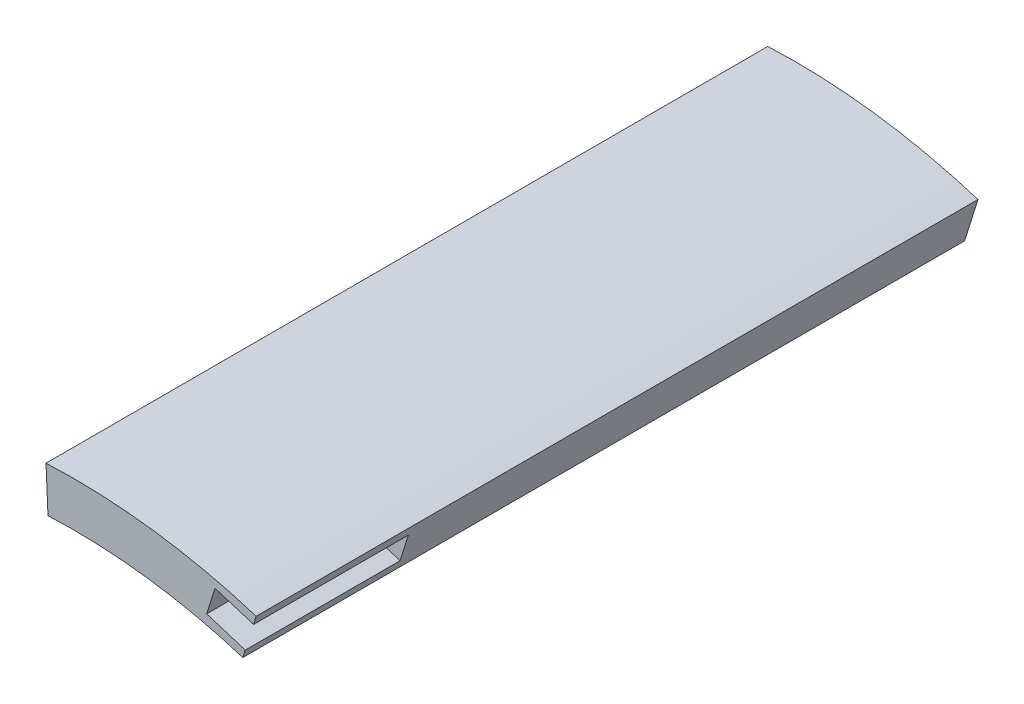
SolidWorks part; units mm, degrees
ref_plane "Přední rovina" through (0, 0, 0) normal (0, 0, 1) x (1, 0, 0)
ref_plane "Horní rovina" through (0, 0, 0) normal (0, 1, 0) x (1, 0, 0)
ref_plane "Pravá rovina" through (0, 0, 0) normal (1, 0, 0) x (0, 0, -1)
sketch "Skica1" plane through (0, 0, 0) normal (0, 0, 1) x (1, 0, 0)
  line L1 (140, -140) -> (-140, -140)
  line L2 (140, -140) -> (140, 140)
  line L3 (140, 140) -> (-140, 140)
  line L4 (-140, -140) -> (-140, 140)
  line L5 (140, -140) -> (-140, 140) construction
  line L6 (140, 140) -> (-140, -140) construction
  point P0 (0, 0)
  dimension "D1" = 280
  dimension "D2" = 280
extrude "Přidat vysunutím1" add sketch "Skica1" along normal blind 162
sketch "Skica2" plane through (0, 140, 0) normal (0, 1, 0) x (1, 0, 0)
  line L0 (-140, 0) -> (-140, -7.25)
  line L1 (-140, -162) -> (-140, 0) construction
  line L2 (-140, -7.25) -> (-140, -14.75)
  line L3 (-140, -14.75) -> (-140, -17.25)
  line L4 (-140, -17.25) -> (-140, -24.75)
  line L5 (-140, -24.75) -> (0, -24.75)
  line L6 (-140, -24.75) -> (-140, -27.25)
  line L7 (-140, -27.25) -> (0, -27.25)
  line L8 (-140, -27.25) -> (-140, -34.75)
  line L9 (-140, -34.75) -> (0, -34.75)
  line L10 (-140, -14.75) -> (0, -14.75)
  line L11 (-140, -37.25) -> (0, -37.25)
  line L12 (-140, -7.25) -> (0, -7.25)
  line L13 (-140, -17.25) -> (0, -17.25)
  line L14 (-140, -34.75) -> (-140, -36)
  line L15 (-140, -36) -> (140, -36) construction
  line L16 (140, -162) -> (140, 0) construction
  line L17 (0, 0) -> (0, -36) construction
  line L18 (-140, -44.75) -> (0, -44.75)
  line L19 (-140, -47.25) -> (0, -47.25)
  line L20 (-140, -54.75) -> (0, -54.75)
  line L21 (-140, -64.75) -> (0, -64.75)
  line L22 (-140, -57.25) -> (0, -57.25)
  line L23 (-140, -64.75) -> (-140, -67.25)
  line L24 (-140, -67.25) -> (-140, -74.75)
  line L25 (-140, -74.75) -> (-140, -77.25)
  line L26 (-140, -77.25) -> (-140, -84.75)
  line L27 (-140, -84.75) -> (0, -84.75)
  line L28 (-140, -84.75) -> (-140, -87.25)
  line L29 (-140, -87.25) -> (0, -87.25)
  line L30 (-140, -87.25) -> (-140, -94.75)
  line L31 (-140, -94.75) -> (0, -94.75)
  line L32 (-140, -74.75) -> (0, -74.75)
  line L33 (-140, -97.25) -> (0, -97.25)
  line L34 (-140, -67.25) -> (0, -67.25)
  line L35 (-140, -77.25) -> (0, -77.25)
  line L36 (-140, -94.75) -> (-140, -96)
  line L37 (0, -59.75) -> (0, -96) construction
  line L38 (-140, -104.75) -> (0, -104.75)
  line L39 (-140, -107.25) -> (0, -107.25)
  line L40 (-140, -114.75) -> (0, -114.75)
  line L41 (-140, -124.75) -> (0, -124.75)
  line L42 (-140, -117.25) -> (0, -117.25)
  line L43 (0, 0) -> (40, 0) construction
  line L44 (140, 0) -> (-140, 0) construction
  line L45 (40, 0) -> (40, -154.75) construction
  line L46 (140, -162) -> (-140, -162) construction
  line L47 (-140, -124.75) -> (-140, -127.25)
  line L48 (-140, -127.25) -> (32.8902, -127.25)
  line L49 (-140, -127.25) -> (-140, -134.75)
  line L50 (-140, -134.75) -> (24.5559, -134.75)
  line L51 (-140, -134.75) -> (-140, -137.25)
  line L52 (-140, -137.25) -> (-140, -144.75)
  line L53 (-140, -137.25) -> (27.0559, -137.25)
  line L54 (-140, -144.75) -> (24.5559, -144.75)
  line L55 (-140, -144.75) -> (-140, -147.25)
  line L56 (-140, -147.25) -> (27.0559, -147.25)
  line L57 (-140, -147.25) -> (-140, -154.75)
  line L58 (-140, -154.75) -> (30.93, -154.75)
  line L59 (30.93, -154.75) -> (40, -154.75)
  line L60 (40, -154.75) -> (40, -127.25)
  arc A0 (0, -27.25) -> (0, -44.75) centre (0, -36) cw
  arc A1 (0, -24.75) -> (0, -47.25) centre (0, -36) cw
  arc A2 (0, -17.25) -> (0, -54.75) centre (0, -36) cw
  arc A3 (0, -14.75) -> (0, -57.25) centre (0, -36) cw
  arc A4 (0, -7.25) -> (0, -64.75) centre (0, -36) cw
  arc A5 (1.25, -36) -> (0, -34.75) centre (0, -36) ccw
  arc A6 (0, -37.25) -> (1.25, -36) centre (0, -36) ccw
  arc A7 (0, -87.25) -> (0, -104.75) centre (0, -96) cw
  arc A8 (0, -84.75) -> (0, -107.25) centre (0, -96) cw
  arc A9 (0, -77.25) -> (0, -114.75) centre (0, -96) cw
  arc A10 (0, -74.75) -> (0, -117.25) centre (0, -96) cw
  arc A11 (0, -67.25) -> (0, -124.75) centre (0, -96) cw
  arc A12 (1.25, -96) -> (0, -94.75) centre (0, -96) ccw
  arc A13 (0, -97.25) -> (1.25, -96) centre (0, -96) ccw
  arc A15 (40, -134.75) -> (32.0884, -127.25) centre (32.4893, -134.75) ccw
  arc A16 (27.0559, -137.25) -> (24.5559, -134.75) centre (24.5559, -137.25) ccw
  arc A17 (27.0559, -147.25) -> (24.5559, -144.75) centre (24.5559, -147.25) ccw
  dimension "D8" = 28.75
  dimension "D9" = 21.25
  dimension "D10" = 18.75
  dimension "D11" = 11.25
  dimension "D12" = 8.75
  dimension "D13" = 28.75
  dimension "D40" = 21.25
  dimension "D41" = 18.75
  dimension "D42" = 11.25
  dimension "D43" = 8.75
  dimension "D44" = 1.25
  dimension "D1" = 7.25
  dimension "D2" = 7.5
  dimension "D3" = 2.5
  dimension "D5" = 2.5
  dimension "D4" = 7.5
  dimension "D6" = 7.5
  dimension "D7" = 1.25
  dimension "D14" = 2.5
  dimension "D15" = 40
  dimension "D16" = 2.5
  dimension "D17" = 7.5
  dimension "D18" = 2.5
  dimension "D19" = 7.5
  dimension "D20" = 2.5
  dimension "D21" = 7.5
  dimension "D22" = 7.25
  dimension "D23" = 7.5
  dimension "D24" = 2.5
  dimension "D25" = 7.5
  dimension "D26" = 2.5
  dimension "D27" = 7.5
  dimension "D28" = 2.5
  dimension "D29" = 7.5
  dimension "D30" = 2.5
  dimension "D31" = 7.5
  dimension "D32" = 2.5
  dimension "D33" = 7.5
  dimension "D34" = 7.5
  dimension "D35" = 2.5
  dimension "D36" = 7.5
  dimension "D37" = 2.5
  dimension "D38" = 7.5
  dimension "D39" = 2.5
extrude "Odebrat vysunutím1" cut sketch "Skica2" against normal through all
sketch "Skica3" plane through (0, 0, 0) normal (0, 0, -1) x (-1, 0, 0)
  line L0 (0, 0) -> (-40, 0)
  line L1 (-140, 140) -> (140, 140)
  line L2 (-140, 140) -> (-140, -140)
  line L3 (-140, -140) -> (140, -140)
  line L4 (140, 140) -> (140, -140)
  line L6 (0, 0) -> (-40, 127.3666)
  line L7 (0, 0) -> (5.9742, 133.3663)
  line L8 (-40, -140) -> (-40, 140) construction
  circle A0 centre (0, 0) radius 130.5
  circle A1 centre (0, 0) radius 133.5
  dimension "D1" = 261
  dimension "D2" = 267
  dimension "D3" = 40
  dimension "D4" = 20
extrude "Odebrat vysunutím3" cut sketch "Skica3" against normal through all
sketch "Skica5" plane through (0, 0, 162) normal (0, 0, 1) x (1, 0, 0)
  line L0 (0, 0) -> (-5.9742, 133.3663)
  line L1 (-5.9742, 133.3663) -> (-6.1309, 136.8628)
  line L2 (0, 0) -> (39.1011, 124.5044)
  line L3 (39.1011, 124.5044) -> (41.0487, 130.7058)
  circle A0 centre (0, 0) radius 137
  circle A1 centre (0, 0) radius 127
  circle A2 centre (0, 0) radius 130.5
  circle A3 centre (0, 0) radius 133.5
  dimension "D1" = 254
  dimension "D2" = 274
extrude "Přidat vysunutím3" add sketch "Skica5" against normal through all contours A1 L2 L0 M1 | L3 A0 L1 M3
sketch "Skica6" plane through (0, 0, 162) normal (0, 0, 1) x (1, 0, 0)
  line L0 (0, 0) -> (40.4494, 128.7977)
  line L1 (38.0524, 121.1652) -> (41.0487, 130.7058) construction
  line L2 (40.4494, 128.7977) -> (38.5948, 122.8921)
  line L4 (40.4494, 128.7977) -> (31.7961, 131.5153)
  line L5 (38.5948, 122.8921) -> (29.9415, 125.6097)
  line L6 (31.7961, 131.5153) -> (29.9415, 125.6097)
  circle A2 centre (0, 0) radius 135
  dimension "D1" = 6.19
  dimension "D2" = 9.07
  dimension "D5" = 270
extrude "Odebrat vysunutím4" cut sketch "Skica6" against normal blind 34.75 contours L0 A2 L6 L5 | A2 L4 L6
scale "Měřítko1" scale about centroid uniform scaling yes scale factor 0.655
